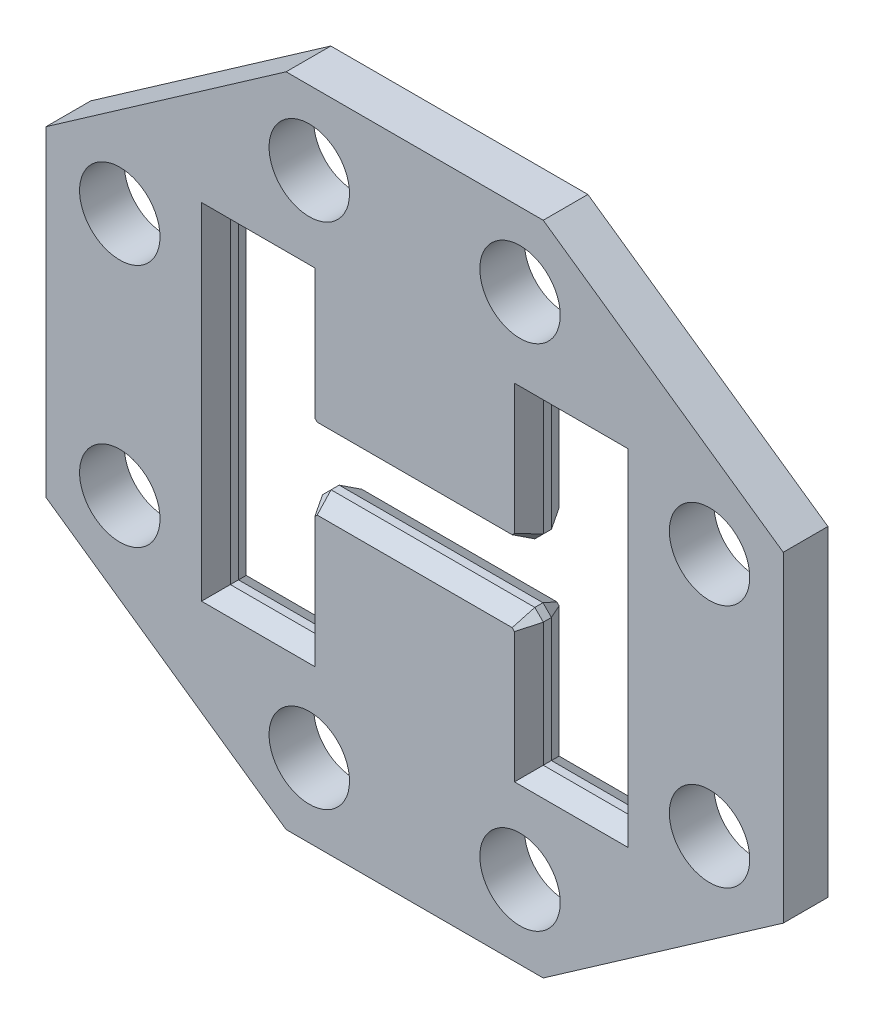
SolidWorks part; units mm, degrees
ref_plane "Front Plane" through (0, 0, 0) normal (1, 0, 0) x (0, 1, 0)
ref_plane "Top Plane" through (0, 0, 0) normal (0, 0, 1) x (0, 1, 0)
ref_plane "Right Plane" through (0, 0, 0) normal (0, 1, 0) x (-1, 0, 0)
sketch "sk W14x730" plane through (0, 0, 0) normal (0, 0, 1) x (0, 1, 0)
  point P0 (0, -284.734)
  point P1 (-38.989, 0)
  line B0 (-227.203, -284.734) -> (-227.203, -160.02)
  line B1 (-227.203, -160.02) -> (-54.229, -160.02)
  line B2 (-38.989, -144.78) -> (-38.989, 144.78)
  line B3 (-54.229, 160.02) -> (-227.203, 160.02)
  line B4 (-227.203, 160.02) -> (-227.203, 284.734)
  line B5 (-227.203, 284.734) -> (227.203, 284.734)
  line B6 (227.203, 284.734) -> (227.203, 160.02)
  line B7 (227.203, 160.02) -> (54.229, 160.02)
  line B8 (38.989, 144.78) -> (38.989, -144.78)
  line B9 (54.229, -160.02) -> (227.203, -160.02)
  line B10 (227.203, -160.02) -> (227.203, -284.734)
  line B11 (227.203, -284.734) -> (-227.203, -284.734)
  arc B12 (-54.229, -160.02) -> (-38.989, -144.78) centre (-54.229, -144.78) ccw
  arc B13 (-38.989, 144.78) -> (-54.229, 160.02) centre (-54.229, 144.78) ccw
  arc B14 (54.229, 160.02) -> (38.989, 144.78) centre (54.229, 144.78) ccw
  arc B15 (38.989, -144.78) -> (54.229, -160.02) centre (54.229, -144.78) ccw
sketch_block_instance "W14x730-113"
sketch_block "W14x730" parameters "D4"=15.24, "D1"=454.406, "D2"=569.468, "D3"=77.978, "D5"=124.714
sketch_block_instance "W14x730-232"
sketch_block_instance "W14x730-233"
sketch_block_instance "W14x730-234"
sketch_block_instance "W14x730-276"
sketch_block_instance "W14x730-277"
sketch_block_instance "W14x730-278"
sketch_block_instance "W14x730-279"
sketch_block_instance "W14x730-280"
sketch_block_instance "W14x730-281"
sketch_block_instance "W14x730-282"
sketch_block_instance "W14x730-283"
sketch_block_instance "W14x730-284"
sketch_block_instance "W14x730-285"
sketch_block_instance "W14x730-286"
sketch_block_instance "W14x730-287"
sketch_block_instance "W14x730-288"
sketch_block_instance "W14x730-289"
sketch_block_instance "W14x730-321"
sketch_block_instance "W14x730-322"
sketch_block_instance "W14x730-323"
sketch_block_instance "W14x730-324"
sketch_block_instance "W14x730-325"
sketch_block_instance "W14x730-326"
sketch_block_instance "W14x730-327"
sketch_block_instance "W14x730-328"
sketch_block_instance "W14x730-329"
sketch_block_instance "W14x730-330"
sketch_block_instance "W14x730-331"
sketch_block_instance "W14x730-332"
sketch_block_instance "W14x730-333"
sketch_block_instance "W14x730-334"
sketch_block_instance "W14x730-335"
sketch_block_instance "W14x730-336"
sketch_block_instance "W14x730-337"
sketch_block_instance "W14x730-338"
sketch_block_instance "W14x730-339"
sketch_block_instance "W14x730-340"
sketch_block_instance "W14x730-341"
sketch_block_instance "W14x730-365"
sketch_block_instance "W14x730-366"
sketch_block_instance "W14x730-367"
sketch_block_instance "W14x730-368"
sketch_block_instance "W14x730-369"
sketch_block_instance "W14x730-370"
sketch_block_instance "W14x730-371"
sketch_block_instance "W14x730-372"
sketch_block_instance "W14x730-373"
sketch_block_instance "W14x730-374"
sketch_block_instance "W14x730-375"
sketch_block_instance "W14x730-376"
sketch_block_instance "W14x730-377"
sketch_block_instance "W14x730-378"
sketch_block_instance "W14x730-379"
sketch_block_instance "W14x730-380"
sketch_block_instance "W14x730-381"
sketch_block_instance "W14x730-382"
sketch_block_instance "W14x730-383"
sketch_block_instance "W14x730-384"
sketch_block_instance "W14x730-385"
sketch_block_instance "W14x730-386"
sketch_block_instance "W14x730-387"
sketch_block_instance "W14x730-388"
sketch_block_instance "W14x730-389"
sketch_block_instance "W14x730-390"
sketch_block_instance "W14x730-391"
sketch_block_instance "W14x730-410"
sketch_block_instance "W14x730-411"
sketch_block_instance "W14x730-412"
sketch_block_instance "W14x730-413"
sketch_block_instance "W14x730-414"
sketch_block_instance "W14x730-415"
sketch_block_instance "W14x730-416"
sketch_block_instance "W14x730-417"
sketch_block_instance "W14x730-418"
sketch_block_instance "W14x730-419"
sketch_block_instance "W14x730-420"
sketch_block_instance "W14x730-421"
sketch_block_instance "W14x730-422"
sketch_block_instance "W14x730-423"
sketch_block_instance "W14x730-424"
sketch_block_instance "W14x730-425"
sketch_block_instance "W14x730-426"
sketch_block_instance "W14x730-427"
sketch_block_instance "W14x730-428"
sketch_block_instance "W14x730-429"
sketch_block_instance "W14x730-430"
sketch_block_instance "W14x730-431"
sketch_block_instance "W14x730-432"
sketch_block_instance "W14x730-433"
sketch_block_instance "W14x730-434"
sketch_block_instance "W14x730-435"
sketch_block_instance "W14x730-436"
sketch_block_instance "W14x730-437"
sketch_block_instance "W14x730-438"
sketch_block_instance "W14x730-439"
sketch_block_instance "W14x730-440"
sketch_block_instance "W14x730-443"
sketch_block_instance "W14x730-454"
sketch_block_instance "W14x730-455"
sketch_block_instance "W14x730-456"
sketch_block_instance "W14x730-457"
sketch_block_instance "W14x730-458"
sketch_block_instance "W14x730-459"
sketch_block_instance "W14x730-460"
sketch_block_instance "W14x730-461"
sketch_block_instance "W14x730-462"
sketch_block_instance "W14x730-463"
sketch_block_instance "W14x730-464"
sketch_block_instance "W14x730-465"
sketch_block_instance "W14x730-466"
sketch_block_instance "W14x730-467"
sketch_block_instance "W14x730-468"
sketch_block_instance "W14x730-469"
sketch_block_instance "W14x730-470"
sketch_block_instance "W14x730-471"
sketch_block_instance "W14x730-472"
sketch_block_instance "W14x730-473"
sketch_block_instance "W14x730-474"
sketch_block_instance "W14x730-475"
sketch_block_instance "W14x730-476"
sketch_block_instance "W14x730-477"
sketch_block_instance "W14x730-478"
sketch_block_instance "W14x730-479"
sketch_block_instance "W14x730-480"
sketch_block_instance "W14x730-481"
sketch_block_instance "W14x730-482"
sketch_block_instance "W14x730-483"
sketch_block_instance "W14x730-484"
sketch_block_instance "W14x730-485"
sketch_block_instance "W14x730-486"
sketch_block_instance "W14x730-487"
sketch_block_instance "W14x730-488"
sketch_block_instance "W14x730-489"
sketch_block_instance "W14x730-490" parameters "D1"=817.9177, "D2"=1027.7361, "D3"=0.4058, "D4"=24.0009, "D5"=0.4058, "D6"=533.4, "D7"=27.3509, "D8"=8374.3758, "D9"=3499.6788, "D10"=18059.4
sketch "sk 4\" hex nut Pattern" plane through (0, 0, 0) normal (0, 0, 1) x (0, 1, 0)
  line L7 (419.0803, -173.5887) -> (419.0803, 173.5887)
  line L8 (419.0803, 173.5887) -> (173.5887, 419.0803)
  line L9 (173.5887, 419.0803) -> (-173.5887, 419.0803)
  line L10 (-173.5887, 419.0803) -> (-419.0803, 173.5887)
  line L11 (-419.0803, 173.5887) -> (-419.0803, -173.5887)
  line L12 (-419.0803, -173.5887) -> (-173.5887, -419.0803)
  line L13 (-173.5887, -419.0803) -> (173.5887, -419.0803)
  line L14 (173.5887, -419.0803) -> (419.0803, -173.5887)
  line L29 (54.229, -125.02) -> (262.203, -125.02)
  line L30 (262.203, -125.02) -> (262.203, -319.734)
  line L31 (-262.203, -125.02) -> (-54.229, -125.02)
  line L32 (-262.203, -319.734) -> (-262.203, -125.02)
  line L33 (262.203, -319.734) -> (-262.203, -319.734)
  line L34 (54.229, -125.02) -> (262.203, -125.02)
  line L35 (262.203, -125.02) -> (262.203, -319.734)
  line L36 (-262.203, -125.02) -> (-54.229, -125.02)
  line L37 (-262.203, -319.734) -> (-262.203, -125.02)
  line L38 (262.203, -319.734) -> (-262.203, -319.734)
  line L39 (-419.0803, 173.5887) -> (419.0803, -173.5887)
  line L40 (419.0803, 173.5887) -> (-419.0803, -173.5887)
  line L42 (-466.3243, 523.8553) -> (466.3243, 523.8553)
  line L43 (-466.3243, 523.8553) -> (-466.3243, -523.8553)
  line L44 (262.203, 125.02) -> (54.229, 125.02)
  line L45 (262.203, 319.734) -> (262.203, 125.02)
  line L46 (-262.203, 319.734) -> (262.203, 319.734)
  line L47 (-262.203, 125.02) -> (-262.203, 319.734)
  line L48 (-54.229, 125.02) -> (-262.203, 125.02)
  line L49 (262.203, 125.02) -> (54.229, 125.02)
  line L50 (262.203, 319.734) -> (262.203, 125.02)
  line L51 (-262.203, 319.734) -> (262.203, 319.734)
  line L52 (-262.203, 125.02) -> (-262.203, 319.734)
  line L53 (-54.229, 125.02) -> (-262.203, 125.02)
  line L54 (-466.3243, -523.8553) -> (466.3243, -523.8553)
  line L55 (466.3243, 523.8553) -> (466.3243, -523.8553)
  circle A0 centre (0, 0) radius 419.0803 construction
  line B0 (-128.6781, -496.8678) -> (-83.7675, -419.0803)
  circle B1 centre (-173.5887, -419.0803) radius 77.7875 construction
  circle B2 centre (-173.5887, -419.0803) radius 50.8
  circle B3 centre (-173.5887, -419.0803) radius 89.8213
  circle B4 centre (-173.5887, -419.0803) radius 99.3463
  line B5 (-83.7675, 419.0803) -> (-128.6781, 496.8678)
  line B6 (-128.6781, 496.8678) -> (-218.4994, 496.8678)
  line B7 (-218.4994, 496.8678) -> (-263.41, 419.0803)
  line B8 (-263.41, 419.0803) -> (-218.4994, 341.2928)
  line B9 (-218.4994, 341.2928) -> (-128.6781, 341.2928)
  circle B10 centre (-173.5887, 419.0803) radius 77.7875 construction
  circle B11 centre (-173.5887, 419.0803) radius 50.8
  circle B12 centre (-173.5887, 419.0803) radius 89.8213
  circle B13 centre (-173.5887, 419.0803) radius 99.3463
  line B14 (263.41, 419.0803) -> (218.4994, 496.8678)
  line B15 (218.4994, 496.8678) -> (128.6781, 496.8678)
  line B16 (128.6781, 496.8678) -> (83.7675, 419.0803)
  line B17 (128.6781, 341.2928) -> (218.4994, 341.2928)
  line B18 (218.4994, 341.2928) -> (263.41, 419.0803)
  circle B19 centre (173.5887, 419.0803) radius 50.8
  circle B20 centre (173.5887, 419.0803) radius 89.8213
  circle B21 centre (173.5887, 419.0803) radius 99.3463
  line B22 (263.41, -419.0803) -> (218.4994, -341.2928)
  line B23 (218.4994, -341.2928) -> (128.6781, -341.2928)
  line B24 (83.7675, -419.0803) -> (128.6781, -496.8678)
  line B25 (128.6781, -496.8678) -> (218.4994, -496.8678)
  line B26 (218.4994, -496.8678) -> (263.41, -419.0803)
  circle B27 centre (173.5887, -419.0803) radius 77.7875 construction
  circle B28 centre (173.5887, -419.0803) radius 50.8
  circle B29 centre (173.5887, -419.0803) radius 89.8213
  circle B30 centre (173.5887, -419.0803) radius 99.3463
  line B31 (-271.728, 149.7586) -> (-316.6386, 227.5461)
  line B32 (-316.6386, 227.5461) -> (-406.4599, 227.5461)
  line B33 (-406.4599, 227.5461) -> (-451.3705, 149.7586)
  line B34 (-451.3705, 149.7586) -> (-406.4599, 71.9711)
  line B35 (-406.4599, 71.9711) -> (-316.6386, 71.9711)
  circle B36 centre (-361.5493, 149.7586) radius 77.7875 construction
  circle B37 centre (-361.5493, 149.7586) radius 50.8
  circle B38 centre (-361.5493, 149.7586) radius 89.8213
  circle B39 centre (-361.5493, 149.7586) radius 99.3463
  line B40 (-271.728, -149.7586) -> (-316.6386, -71.9711)
  line B41 (-316.6386, -71.9711) -> (-406.4599, -71.9711)
  line B42 (-406.4599, -71.9711) -> (-451.3705, -149.7586)
  line B43 (-451.3705, -149.7586) -> (-406.4599, -227.5461)
  line B44 (-406.4599, -227.5461) -> (-316.6386, -227.5461)
  line B45 (-316.6386, -227.5461) -> (-271.728, -149.7586)
  circle B46 centre (-361.5493, -149.7586) radius 77.7875 construction
  circle B47 centre (-361.5493, -149.7586) radius 50.8
  circle B48 centre (-361.5493, -149.7586) radius 89.8213
  circle B49 centre (-361.5493, -149.7586) radius 99.3463
  line B50 (451.3705, 149.7586) -> (406.4599, 227.5461)
  line B51 (406.4599, 227.5461) -> (316.6386, 227.5461)
  line B52 (316.6386, 227.5461) -> (271.728, 149.7586)
  line B53 (316.6386, 71.9711) -> (406.4599, 71.9711)
  circle B54 centre (361.5493, 149.7586) radius 77.7875 construction
  circle B55 centre (361.5493, 149.7586) radius 50.8
  circle B56 centre (361.5493, 149.7586) radius 89.8213
  circle B57 centre (361.5493, 149.7586) radius 99.3463
  line B58 (316.6386, -71.9711) -> (271.728, -149.7586)
  line B59 (406.4599, -227.5461) -> (451.3705, -149.7586)
  circle B60 centre (361.5493, -149.7586) radius 77.7875 construction
  circle B61 centre (361.5493, -149.7586) radius 50.8
  circle B62 centre (361.5493, -149.7586) radius 89.8213
  circle B63 centre (361.5493, -149.7586) radius 99.3463
sketch_block_instance "4\" hex nut-1"
sketch_block "4\" hex nut" parameters "D1"=155.575, "D2"=101.6, "D3"=9.525
sketch_block_instance "4\" hex nut-2"
sketch_block_instance "4\" hex nut-3"
sketch_block_instance "4\" hex nut-4"
sketch_block_instance "4\" hex nut-5"
sketch_block_instance "4\" hex nut-6"
sketch_block_instance "4\" hex nut-7"
sketch_block_instance "4\" hex nut-8" parameters "D1"=129.9071, "D2"=77.383, "D3"=138.8929, "D4"=187.7059, "D5"=195.0068, "D6"=231.3326
sketch "Sketch3" plane through (0, 0, 0) normal (0, 0, 1) x (0, 1, 0)
  line L0 (-466.3243, 523.8553) -> (466.3243, 523.8553) construction
  line L1 (466.3243, 523.8553) -> (466.3243, -523.8553) construction
  line L2 (-466.3243, -523.8553) -> (466.3243, -523.8553) construction
  line L3 (-466.3243, 523.8553) -> (-466.3243, -523.8553) construction
  line L4 (228.2342, 523.8553) -> (466.3243, 182.7049)
  line L5 (466.3243, 182.7049) -> (466.3243, -182.7049)
  line L6 (466.3243, -182.7049) -> (228.2342, -523.8553)
  line L7 (228.2342, -523.8553) -> (-228.2342, -523.8553)
  line L8 (-228.2342, -523.8553) -> (-466.3243, -182.7049)
  line L9 (-466.3243, -182.7049) -> (-466.3243, 182.7049)
  line L10 (-466.3243, 182.7049) -> (-228.2342, 523.8553)
  line L11 (-228.2342, 523.8553) -> (228.2342, 523.8553)
  line L93 (-54.229, 156.845) -> (-230.378, 156.845)
  line L94 (-230.378, 156.845) -> (-230.378, 287.909)
  line L95 (230.378, 156.845) -> (54.229, 156.845)
  line L96 (230.378, 287.909) -> (230.378, 156.845)
  line L97 (-230.378, 287.909) -> (230.378, 287.909)
  line L98 (-54.229, 156.845) -> (-230.378, 156.845)
  line L99 (-230.378, 156.845) -> (-230.378, 287.909)
  line L100 (230.378, 156.845) -> (54.229, 156.845)
  line L101 (230.378, 287.909) -> (230.378, 156.845)
  line L102 (-230.378, 287.909) -> (230.378, 287.909)
  line L118 (54.229, -156.845) -> (230.378, -156.845)
  line L119 (230.378, -156.845) -> (230.378, -287.909)
  line L120 (230.378, -287.909) -> (-230.378, -287.909)
  line L121 (-230.378, -287.909) -> (-230.378, -156.845)
  line L122 (-230.378, -156.845) -> (-54.229, -156.845)
  line L123 (54.229, -156.845) -> (230.378, -156.845)
  line L124 (230.378, -156.845) -> (230.378, -287.909)
  line L125 (230.378, -287.909) -> (-230.378, -287.909)
  line L126 (-230.378, -287.909) -> (-230.378, -156.845)
  line L127 (-230.378, -156.845) -> (-54.229, -156.845)
  line L130 (42.164, 144.78) -> (42.164, -144.78)
  line L131 (42.164, 144.78) -> (42.164, -144.78)
  line L132 (-54.229, 156.845) -> (-42.164, 144.78)
  line L133 (-42.164, -144.78) -> (-42.164, 144.78)
  line L134 (-42.164, -144.78) -> (-42.164, 144.78)
  line L135 (42.164, 144.78) -> (54.229, 156.845)
  line L136 (42.164, -144.78) -> (54.229, -156.845)
  line L137 (-54.229, -156.845) -> (-42.164, -144.78)
  circle A0 centre (173.5887, 419.0803) radius 104.775 construction
  circle A1 centre (-173.5887, 419.0803) radius 104.775 construction
  circle A2 centre (-361.5493, 149.7586) radius 104.775 construction
  circle A3 centre (-361.5493, -149.7586) radius 104.775 construction
  circle A4 centre (-173.5887, -419.0803) radius 104.775 construction
  circle A5 centre (173.5887, -419.0803) radius 104.775 construction
  circle A6 centre (361.5493, -149.7586) radius 104.775 construction
  circle A7 centre (361.5493, 149.7586) radius 104.775 construction
  dimension "D1" = 3.175
  dimension "D2" = 3.175
  dimension "D3" = 3.175
  dimension "D4" = 3.175
extrude "Main Plate" add sketch "Sketch3" along normal mid plane 63.5
chamfer "Chamfer4" distance 15 angle 60 16 edges at (156.845, -142.3035, 31.75) (222.377, -230.378, 31.75) (287.909, 0, 31.75) (222.377, 230.378, 31.75) (156.845, 142.3035, 31.75) (150.8125, 48.1965, 31.75) (0, 42.164, 31.75) (-150.8125, 48.1965, 31.75) (-156.845, 142.3035, 31.75) (-222.377, 230.378, 31.75) (-287.909, 0, 31.75) (-222.377, -230.378, 31.75) (-156.845, -142.3035, 31.75) (-150.8125, -48.1965, 31.75) (0, -42.164, 31.75) (150.8125, -48.1965, 31.75)
chamfer "Chamfer5" distance 15 angle 60 16 edges at (-156.845, -142.3035, -31.75) (-222.377, -230.378, -31.75) (-287.909, 0, -31.75) (-222.377, 230.378, -31.75) (-156.845, 142.3035, -31.75) (0, 42.164, -31.75) (156.845, 142.3035, -31.75) (222.377, 230.378, -31.75) (287.909, 0, -31.75) (222.377, -230.378, -31.75) (156.845, -142.3035, -31.75) (0, -42.164, -31.75) (-150.8125, -48.1965, -31.75) (-150.8125, 48.1965, -31.75) (150.8125, 48.1965, -31.75) (150.8125, -48.1965, -31.75)
sketch "Sketch5" plane through (0, 0, 0) normal (0, 0, 1) x (0, 1, 0)
  circle A0 centre (-173.5887, 419.0803) radius 57.15
  circle A1 centre (173.5887, 419.0803) radius 57.15
  circle A2 centre (361.5493, 149.7586) radius 57.15
  circle A3 centre (361.5493, -149.7586) radius 57.15
  circle A4 centre (173.5887, -419.0803) radius 57.15
  circle A5 centre (-173.5887, -419.0803) radius 57.15
  circle A6 centre (-361.5493, -149.7586) radius 57.15
  circle A7 centre (-361.5493, 149.7586) radius 57.15
  dimension "D1" = 114.3
  dimension "D2" = 114.3
  dimension "D3" = 114.3
  dimension "D4" = 114.3
  dimension "D5" = 114.3
  dimension "D6" = 114.3
  dimension "D7" = 114.3
  dimension "D8" = 114.3
extrude "Cut-Extrude1" cut sketch "Sketch5" against normal through all both and the other way through all
